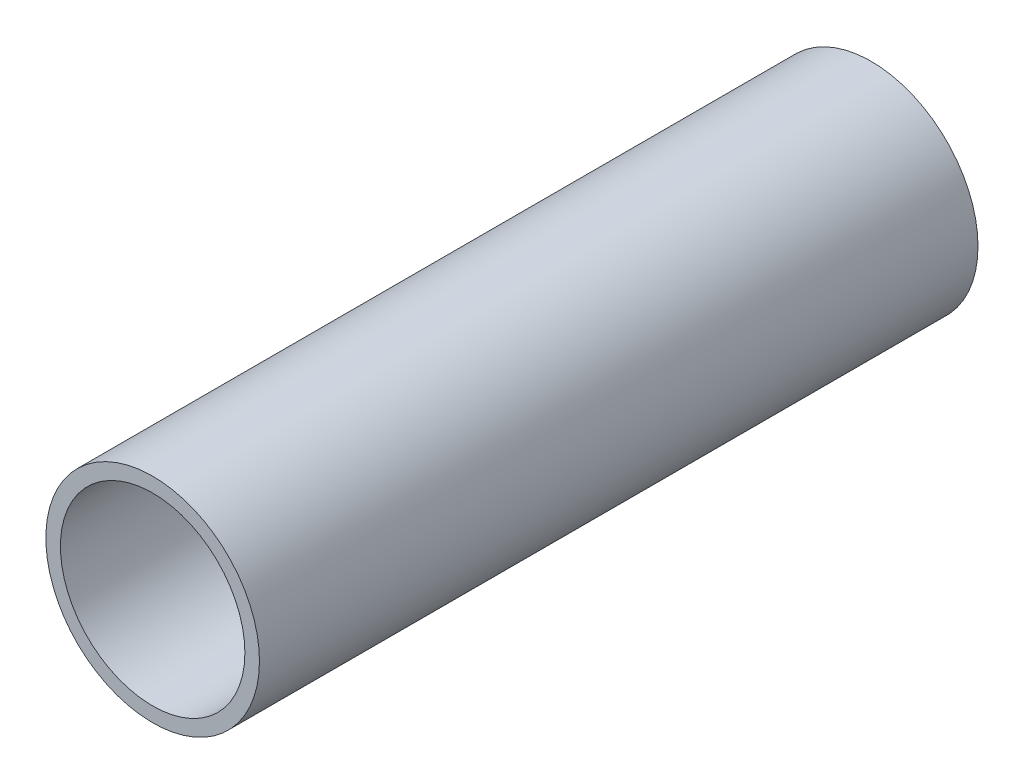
SolidWorks part; units mm, degrees
ref_plane "Front Plane" through (0, 0, 0) normal (0, 0, 1) x (1, 0, 0)
ref_plane "Top Plane" through (0, 0, 0) normal (0, 1, 0) x (1, 0, 0)
ref_plane "Right Plane" through (0, 0, 0) normal (1, 0, 0) x (0, 0, -1)
sketch "Sketch1" plane through (0, 0, 0) normal (0, 0, 1) x (1, 0, 0)
  circle A0 centre (0, 0) radius 5.5
  dimension "D1" = 11
extrude "Boss-Extrude1" add sketch "Sketch1" along normal blind 37 contours A0
sketch "Sketch2" plane through (0, 0, 37) normal (0, 0, 1) x (1, 0, 0)
  circle A0 centre (0, 0) radius 4.75
  dimension "D1" = 9.5
extrude "Cut-Extrude1" cut sketch "Sketch2" against normal blind 37
